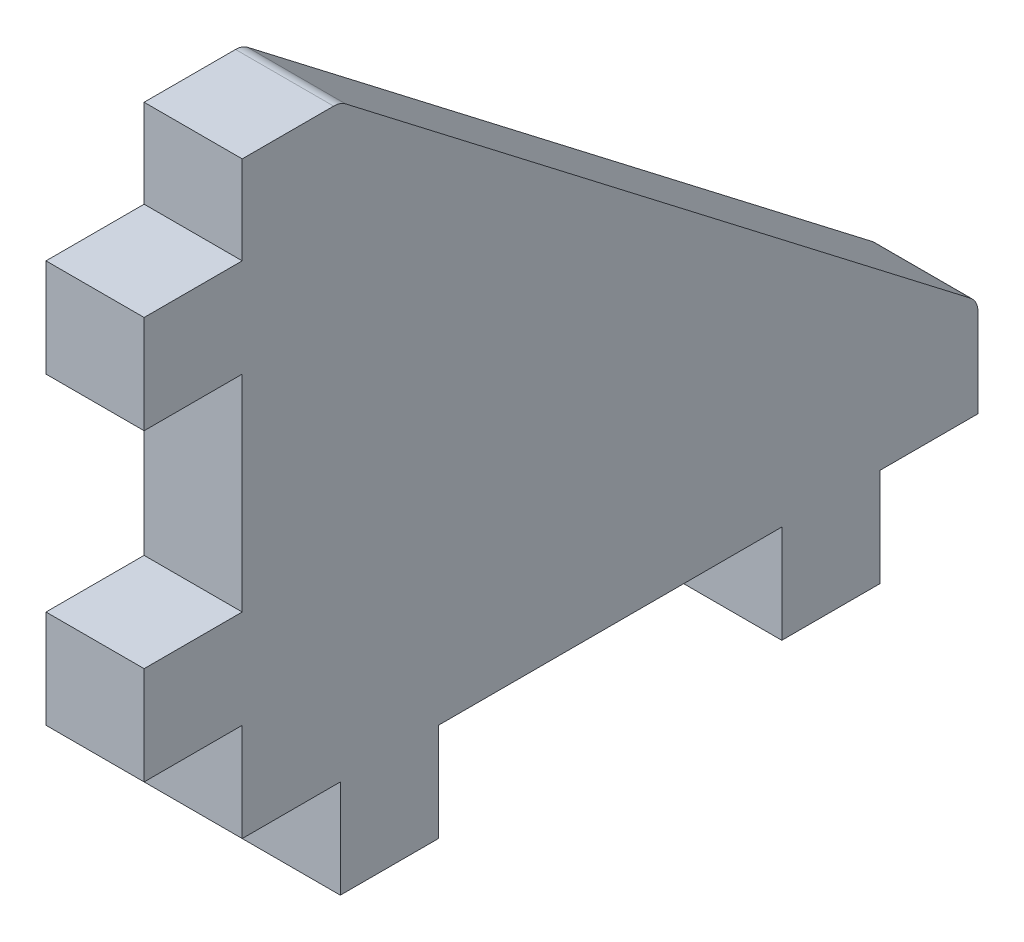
SolidWorks part; units mm, degrees
ref_plane "Piano frontale" through (0, 0, 0) normal (0, 0, 1) x (1, 0, 0)
ref_plane "Piano superiore" through (0, 0, 0) normal (0, 1, 0) x (1, 0, 0)
ref_plane "Piano destro" through (0, 0, 0) normal (1, 0, 0) x (0, 0, -1)
sketch "Schizzo1" plane through (0, 0, 0) normal (1, 0, 0) x (0, 0, -1)
  line L0 (0, 0) -> (20, 0)
  line L1 (150, 0) -> (150, 20)
  line L2 (0, 0) -> (0, 20)
  line L3 (0, 120) -> (20, 120)
  line L4 (20, 120) -> (150, 20)
  line L5 (20, 0) -> (20, -20)
  line L6 (20, -20) -> (40, -20)
  line L7 (40, -20) -> (40, 0)
  line L8 (130, 0) -> (130, -20)
  line L9 (130, -20) -> (110, -20)
  line L10 (110, -20) -> (110, 0)
  line L11 (0, 20) -> (-20, 20)
  line L12 (-20, 20) -> (-20, 40)
  line L13 (-20, 40) -> (0, 40)
  line L14 (0, 102) -> (-20, 102)
  line L15 (-20, 102) -> (-20, 82)
  line L16 (-20, 82) -> (0, 82)
  line L17 (0, 102) -> (0, 120)
  line L18 (0, 40) -> (0, 82)
  line L19 (40, 0) -> (110, 0)
  line L20 (130, 0) -> (150, 0)
extrude "Estrusione-Estrusione1" add sketch "Schizzo1" along normal blind 20
fillet "Raccordo1" radius 4 2 edges at (10, 20, -150) (10, 120, -20)
